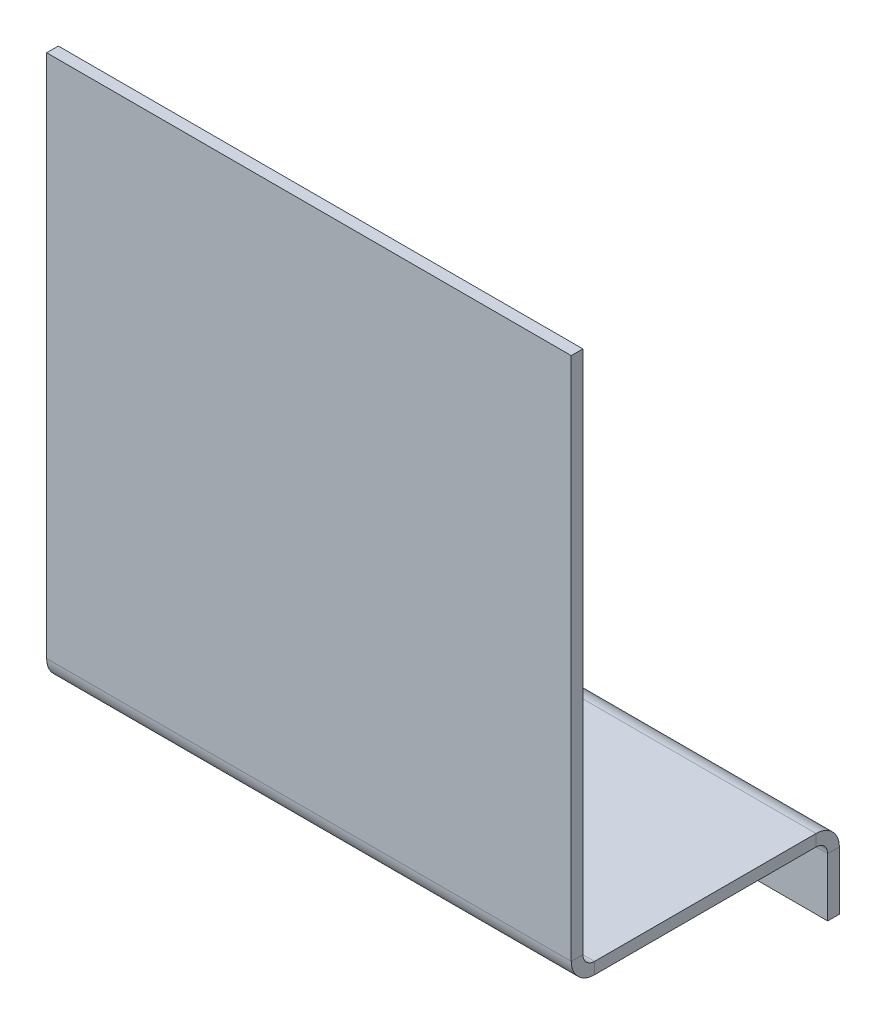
SolidWorks part; units mm, degrees
ref_plane "Vorne" through (0, 0, 0) normal (0, 0, 1) x (1, 0, 0)
ref_plane "Oben" through (0, 0, 0) normal (0, 1, 0) x (1, 0, 0)
ref_plane "Rechts" through (0, 0, 0) normal (1, 0, 0) x (0, 0, -1)
sketch "Skizze1" plane through (0, 0, 0) normal (1, 0, 0) x (0, 0, -1)
  line L0 (0, 45) -> (0, -45)
  dimension "D1" = 90
extrude "Linear-Austragen-Dünn1" add sketch "Skizze1" along normal mid plane 90 thin
sheet metal parameters "Blech1" parameters "D1"=2
flatten bends "Abwickeln1" parameters "D1"=0
sketch "Skizze-Winkel1" plane through (0, 0, 2) normal (0, 0, 1) x (1, 0, 0)
process bends "Abbiegen1" parameters "D1"=0
sketch "Abwicklung-Skizze1" plane through (0, 0, 2) normal (0, 0, 1) x (1, 0, 0)
edge flange "Kante-Lasche1" sketch "Skizze6" bend radius 2 parameters "D6"=10
sketch "Skizze6" plane through (0, -45, 0) normal (0, -1, 0) x (-1, 0, 0)
  line L0 (-45, 0) -> (45, 0) construction
  line L1 (-45, 0) -> (45, 0)
  line L2 (-45, 0) -> (-45, 40)
  line L3 (-45, 40) -> (45, 40)
  line L4 (45, 40) -> (45, 0)
bend "Kantenbiegung1" bend radius 2 bend angle 90 parameters "D5"=1
hole_wizard "Durchgangsloch für M61" positions "Skizze9" profile "Skizze8" hole size "M6" standard "DIN"
sketch "Skizze9" plane through (0, -47, 0) normal (0, 1, 0) x (-1, 0, 0)
  line L1 (-45, -2) -> (45, -2) construction
  point P0 (0, -12)
  dimension "D1" = 10
sketch "Skizze8" plane through (0, -47, -12) normal (1, 0, 0) x (0, 0, 1)
  line L0 (0, 0) -> (0, 2)
  line L1 (0, 2) -> (3.2, 2)
  line L2 (3.2, 2) -> (3.2, 0)
  line L5 (3.2, 0) -> (0, 0)
  line L11 (0, -6.35) -> (0, 107.95) construction
  dimension "Bohrerdurchmesser" = 6.4
  dimension "Bohrungstiefe" = 2
edge flange "Kante-Lasche3" sketch "Skizze17" bend radius 2 parameters "D1"=0, "D6"=10
sketch "Skizze17" plane through (0, -49, -40) normal (0, 0, -1) x (1, 0, 0)
  line L2 (-45, 0) -> (-45, 12)
  line L3 (-45, 12) -> (45, 12)
  line L4 (45, 12) -> (45, 0)
  line L5 (-45, 0) -> (45, 0) construction
  line L6 (-45, 0) -> (45, 0)
bend "Kantenbiegung3" bend radius 2 bend angle 90 parameters "D5"=2
hole_wizard "Durchgangsloch für M41" positions "Skizze14" profile "Skizze13" hole size "M4" standard "DIN"
sketch "Skizze14" plane through (10.0849, -79.0284, -44) normal (0, 0, 1) x (-1, 0, 0)
  line L1 (-34.9151, -18.0284) -> (55.0849, -18.0284) construction
  point P0 (10.0849, -23.0284)
  dimension "D1" = 5
sketch "Skizze13" plane through (0, -56, -44) normal (1, 0, 0) x (0, 1, 0)
  line L0 (0, 0) -> (0, 2)
  line L1 (0, 2) -> (2.15, 2)
  line L2 (2.15, 2) -> (2.15, 0)
  line L5 (2.15, 0) -> (0, 0)
  line L11 (0, -6.35) -> (0, 107.95) construction
  dimension "Bohrerdurchmesser" = 4.3
  dimension "Bohrungstiefe" = 2
sketch "Skizze18" plane through (0, 0, 0) normal (0, 0, -1) x (-1, 0, 0)
  circle A0 centre (0, 0) radius 20
  dimension "D1" = 40
sketch "Skizze19" plane through (0, 0, 0) normal (0, 0, -1) x (-1, 0, 0)
  circle A0 centre (0, 0) radius 15
  dimension "D1" = 30
sketch "Skizze20" plane through (0, 0, 0) normal (0, 0, -1) x (-1, 0, 0)
  circle A0 centre (0, 0) radius 10
  dimension "D1" = 20
sketch "Skizze21" plane through (0, 0, 0) normal (0, 0, -1) x (-1, 0, 0)
  circle A0 centre (0, 0) radius 5
  dimension "D1" = 10
sketch "Skizze22" plane through (0, 0, 0) normal (0, 0, -1) x (-1, 0, 0)
  line L0 (-20, 0) -> (20, 0)
  circle A0 centre (0, 0) radius 20 construction
sketch "Skizze23" plane through (0, 0, 0) normal (0, 0, -1) x (-1, 0, 0)
  line L0 (0, 20) -> (0, -20)
  arc A0 (20, 0) -> (-20, 0) centre (0, 0) ccw construction
  arc A1 (-20, 0) -> (20, 0) centre (0, 0) ccw construction
other "Masseinheiten1"
flat pattern "Abwicklung1"
sketch "Biegung-Linien1" plane through (0, 0, 0) normal (0, 1, 0) x (-1, 0, 0)
bend of the flat pattern "Abwickeln-<Kantenbiegung1>1"
bend of the flat pattern "Abwickeln-<Kantenbiegung3>1"
